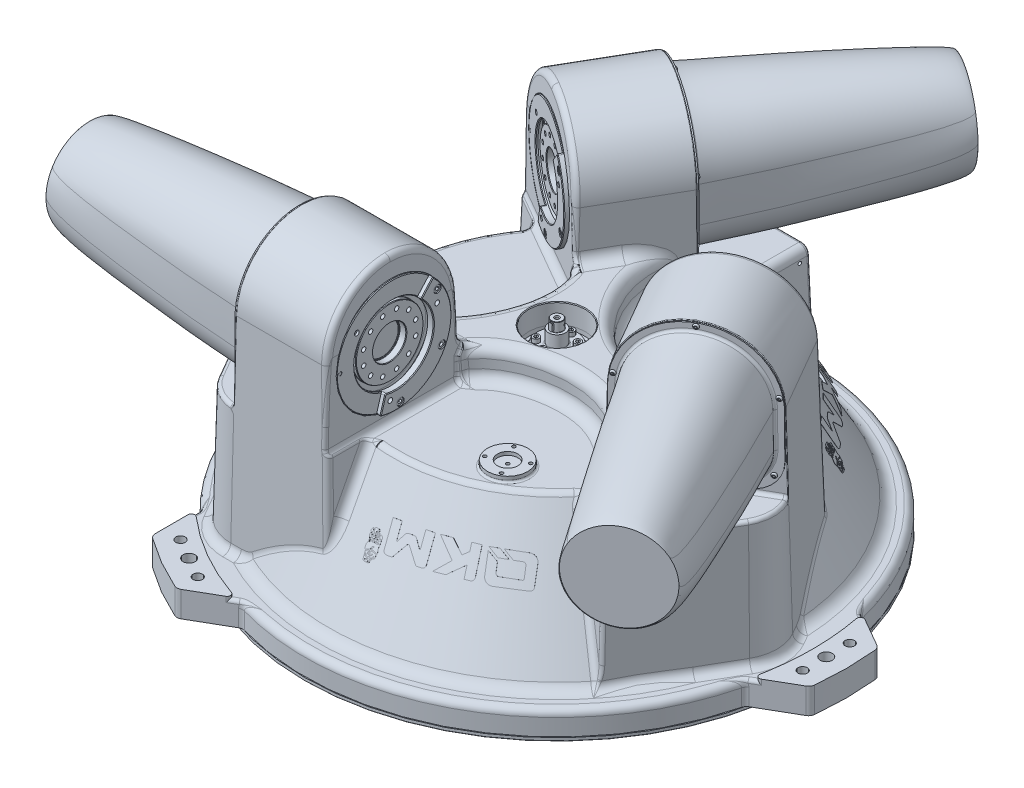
SolidWorks part; units mm, degrees
ref_plane "前视基准面" through (0, 0, 0) normal (0, 0, 1) x (1, 0, 0)
ref_plane "上视基准面" through (0, 0, 0) normal (0, 1, 0) x (1, 0, 0)
ref_plane "右视基准面" through (0, 0, 0) normal (1, 0, 0) x (0, 0, -1)
imported_body "AP20X-1600-1544-T1-V1.0.0-1-surface1"
imported_body "AP20X-1600-1544-T1-V1.0.0-1-surface2"
imported_body "AP20X-1600-1544-T1-V1.0.0-1-surface3"
imported_body "AP20X-1600-1544-T1-V1.0.0-1-surface4"
imported_body "AP20X-1600-1544-T1-V1.0.0-1-surface5"
imported_body "AP20X-1600-1544-T1-V1.0.0-1-surface6"
imported_body "AP20X-1600-1544-T1-V1.0.0-1-surface7"
imported_body "AP20X-1600-1544-T1-V1.0.0-1-surface8"
imported_body "AP20X-1600-1544-T1-V1.0.0-1-surface9"
imported_body "AP20X-1600-1544-T1-V1.0.0-1-surface10"
imported_body "AP20X-1600-1544-T1-V1.0.0-1-surface11"
imported_body "AP20X-1600-1544-T1-V1.0.0-1-surface12"
imported_body "AP20X-1600-1544-T1-V1.0.0-1-surface13"
imported_body "AP20X-1600-1544-T1-V1.0.0-1-surface14"
imported_body "AP20X-1600-1544-T1-V1.0.0-1-surface15"
imported_body "AP20X-1600-1544-T1-V1.0.0-1-surface16"
imported_body "AP20X-1600-1544-T1-V1.0.0-1-surface17"
imported_body "AP20X-1600-1544-T1-V1.0.0-1-surface18"
imported_body "AP20X-1600-1544-T1-V1.0.0-1-surface19"
imported_body "AP20X-1600-1544-T1-V1.0.0-1-surface20"
imported_body "AP20X-1600-1544-T1-V1.0.0-1-surface21"
imported_body "AP20X-1600-1544-T1-V1.0.0-1-surface22"
imported_body "AP20X-1600-1544-T1-V1.0.0-1-surface23"
imported_body "AP20X-1600-1544-T1-V1.0.0-1-surface24"
imported_body "AP20X-1600-1544-T1-V1.0.0-1-surface25"
imported_body "AP20X-1600-1544-T1-V1.0.0-1-surface26"
imported_body "AP20X-1600-1544-T1-V1.0.0-1-surface27"
imported_body "AP20X-1600-1544-T1-V1.0.0-1-surface28"
imported_body "AP20X-1600-1544-T1-V1.0.0-1-surface29"
imported_body "AP20X-1600-1544-T1-V1.0.0-1-surface30"
imported_body "AP20X-1600-1544-T1-V1.0.0-1-surface31"
imported_body "AP20X-1600-1544-T1-V1.0.0-1-surface32"
imported_body "AP20X-1600-1544-T1-V1.0.0-1-surface33"
imported_body "AP20X-1600-1544-T1-V1.0.0-1-surface34"
imported_body "AP20X-1600-1544-T1-V1.0.0-1-surface35"
imported_body "AP20X-1600-1544-T1-V1.0.0-1-surface36"
imported_body "AP20X-1600-1544-T1-V1.0.0-1-surface37"
imported_body "AP20X-1600-1544-T1-V1.0.0-1-surface38"
imported_body "AP20X-1600-1544-T1-V1.0.0-1-surface39"
imported_body "AP20X-1600-1544-T1-V1.0.0-1-surface40"
imported_body "AP20X-1600-1544-T1-V1.0.0-1-surface41"
imported_body "AP20X-1600-1544-T1-V1.0.0-1-surface42"
imported_body "AP20X-1600-1544-T1-V1.0.0-1-surface43"
imported_body "AP20X-1600-1544-T1-V1.0.0-1-surface44"
imported_body "AP20X-1600-1544-T1-V1.0.0-1-surface45"
imported_body "AP20X-1600-1544-T1-V1.0.0-1-surface46"
imported_body "AP20X-1600-1544-T1-V1.0.0-1-surface47"
imported_body "AP20X-1600-1544-T1-V1.0.0-1-surface48"
imported_body "AP20X-1600-1544-T1-V1.0.0-1-surface49"
imported_body "AP20X-1600-1544-T1-V1.0.0-1-surface50"
imported_body "AP20X-1600-1544-T1-V1.0.0-1-surface51"
imported_body "AP20X-1600-1544-T1-V1.0.0-1-surface52"
imported_body "AP20X-1600-1544-T1-V1.0.0-1-surface53"
imported_body "AP20X-1600-1544-T1-V1.0.0-1-surface54"
imported_body "AP20X-1600-1544-T1-V1.0.0-1-surface55"
imported_body "AP20X-1600-1544-T1-V1.0.0-1-surface56"
imported_body "AP20X-1600-1544-T1-V1.0.0-1-surface57"
imported_body "AP20X-1600-1544-T1-V1.0.0-1-surface58"
imported_body "AP20X-1600-1544-T1-V1.0.0-1-surface59"
imported_body "AP20X-1600-1544-T1-V1.0.0-1-surface60"
imported_body "AP20X-1600-1544-T1-V1.0.0-1-surface61"
imported_body "AP20X-1600-1544-T1-V1.0.0-1-surface62"
imported_body "AP20X-1600-1544-T1-V1.0.0-1-surface63"
imported_body "AP20X-1600-1544-T1-V1.0.0-1-surface64"
imported_body "AP20X-1600-1544-T1-V1.0.0-1-surface65"
imported_body "AP20X-1600-1544-T1-V1.0.0-1-surface66"
imported_body "AP20X-1600-1544-T1-V1.0.0-1-surface67"
imported_body "AP20X-1600-1544-T1-V1.0.0-1-surface68"
imported_body "AP20X-1600-1544-T1-V1.0.0-1-surface69"
imported_body "AP20X-1600-1544-T1-V1.0.0-1-surface70"
imported_body "AP20X-1600-1544-T1-V1.0.0-1-surface71"
imported_body "AP20X-1600-1544-T1-V1.0.0-1-surface72"
imported_body "AP20X-1600-1544-T1-V1.0.0-1-surface73"
imported_body "AP20X-1600-1544-T1-V1.0.0-1-surface74"
imported_body "AP20X-1600-1544-T1-V1.0.0-1-surface75"
imported_body "AP20X-1600-1544-T1-V1.0.0-1-surface76"
imported_body "AP20X-1600-1544-T1-V1.0.0-1-surface77"
imported_body "AP20X-1600-1544-T1-V1.0.0-1-surface78"
imported_body "AP20X-1600-1544-T1-V1.0.0-1-surface79"
imported_body "AP20X-1600-1544-T1-V1.0.0-1-surface80"
imported_body "AP20X-1600-1544-T1-V1.0.0-1-surface81"
imported_body "AP20X-1600-1544-T1-V1.0.0-1-surface82"
imported_body "AP20X-1600-1544-T1-V1.0.0-1-surface83"
imported_body "AP20X-1600-1544-T1-V1.0.0-1-surface84"
imported_body "AP20X-1600-1544-T1-V1.0.0-1-surface85"
imported_body "AP20X-1600-1544-T1-V1.0.0-1-surface86"
imported_body "AP20X-1600-1544-T1-V1.0.0-1-surface87"
imported_body "AP20X-1600-1544-T1-V1.0.0-1-surface88"
imported_body "AP20X-1600-1544-T1-V1.0.0-1-surface89"
imported_body "AP20X-1600-1544-T1-V1.0.0-1-surface90"
imported_body "AP20X-1600-1544-T1-V1.0.0-1-surface91"
imported_body "AP20X-1600-1544-T1-V1.0.0-1-surface92"
imported_body "AP20X-1600-1544-T1-V1.0.0-1-surface93"
imported_body "AP20X-1600-1544-T1-V1.0.0-1-surface94"
imported_body "AP20X-1600-1544-T1-V1.0.0-1-surface95"
imported_body "AP20X-1600-1544-T1-V1.0.0-1-surface96"
imported_body "AP20X-1600-1544-T1-V1.0.0-1-surface97"
imported_body "AP20X-1600-1544-T1-V1.0.0-1-surface98"
imported_body "AP20X-1600-1544-T1-V1.0.0-1-surface99"
imported_body "AP20X-1600-1544-T1-V1.0.0-1-surface100"
imported_body "AP20X-1600-1544-T1-V1.0.0-1-surface101"
imported_body "AP20X-1600-1544-T1-V1.0.0-1-surface102"
imported_body "AP20X-1600-1544-T1-V1.0.0-1-surface103"
imported_body "AP20X-1600-1544-T1-V1.0.0-1-surface104"
imported_body "AP20X-1600-1544-T1-V1.0.0-1-surface105"
imported_body "AP20X-1600-1544-T1-V1.0.0-1-surface106"
imported_body "AP20X-1600-1544-T1-V1.0.0-1-surface107"
imported_body "AP20X-1600-1544-T1-V1.0.0-1-surface108"
imported_body "AP20X-1600-1544-T1-V1.0.0-1-surface109"
imported_body "AP20X-1600-1544-T1-V1.0.0-1-surface110"
imported_body "AP20X-1600-1544-T1-V1.0.0-1-surface111"
imported_body "AP20X-1600-1544-T1-V1.0.0-1-surface112"
imported_body "AP20X-1600-1544-T1-V1.0.0-1-surface113"
imported_body "AP20X-1600-1544-T1-V1.0.0-1-surface114"
imported_body "AP20X-1600-1544-T1-V1.0.0-1-surface115"
imported_body "AP20X-1600-1544-T1-V1.0.0-1-surface116"
imported_body "AP20X-1600-1544-T1-V1.0.0-1-surface117"
imported_body "AP20X-1600-1544-T1-V1.0.0-1-surface118"
imported_body "AP20X-1600-1544-T1-V1.0.0-1-surface119"
imported_body "AP20X-1600-1544-T1-V1.0.0-1-surface120"
imported_body "AP20X-1600-1544-T1-V1.0.0-1-surface121"
imported_body "AP20X-1600-1544-T1-V1.0.0-1-surface122"
imported_body "AP20X-1600-1544-T1-V1.0.0-1-surface123"
imported_body "AP20X-1600-1544-T1-V1.0.0-1-surface124"
imported_body "AP20X-1600-1544-T1-V1.0.0-1-surface125"
imported_body "AP20X-1600-1544-T1-V1.0.0-1-surface126"
imported_body "AP20X-1600-1544-T1-V1.0.0-1-surface127"
imported_body "AP20X-1600-1544-T1-V1.0.0-1-surface128"
imported_body "QKM111-1-solid1"
imported_body "QKM111-1-solid2"
imported_body "QKM111-1-solid3"
imported_body "QKM111-1-solid4"
imported_body "QKM111-1-solid5"
imported_body "QKM111-1-solid6"
imported_body "QKM111-1-solid7"
imported_body "QKM111-1-solid8"
imported_body "QKM111-1-solid9"
imported_body "QKM111-1-solid10"
imported_body "QKM111-1-solid11"
imported_body "QKM111-1-solid12"
imported_body "QKM111-1-solid13"
imported_body "QKM111-1-solid14"
imported_body "QKM111-1-solid15"
imported_body "QKM111-1-solid16"
imported_body "QKM111-1-solid17"
imported_body "QKM111-1-solid18"
imported_body "QKM111-1-solid19"
imported_body "QKM111-1-solid20"
imported_body "QKM111-1-solid21"
imported_body "QKM111-1-solid22"
imported_body "QKM111-1-solid23"
imported_body "QKM111-1-solid24"
imported_body "QKM111-1-solid25"
imported_body "QKM111-1-solid26"
imported_body "QKM111-1-solid27"
imported_body "QKM111-1-solid28"
imported_body "QKM111-1-solid29"
imported_body "QKM111-1-solid30"
imported_body "QKM111-1-solid31"
imported_body "QKM111-1-solid32"
imported_body "QKM111-1-solid33"
sketch "草图1" plane through (0, 0, -335.3056) normal (0, 0, -1) x (-1, 0, 0)
  line L0 (21.4661, 84.75) -> (-2.6118, 84.75) construction
  line L1 (15.4661, 154.75) -> (0, 154.75) construction
  circle A0 centre (9.4661, 99.75) radius 8 construction
  circle A1 centre (9.4661, 169.75) radius 7.1784 construction
  circle A2 centre (9.4661, 169.75) radius 8.7252 construction
  text T0 "System LED"
  text T1 "Brake"
  dimension "D1" = 15
  dimension "D2" = 12
  dimension "D3" = 15
  dimension "D4" = 6
extrude "凸台-拉伸1" add sketch "草图1" along normal blind 0.1 separate body
